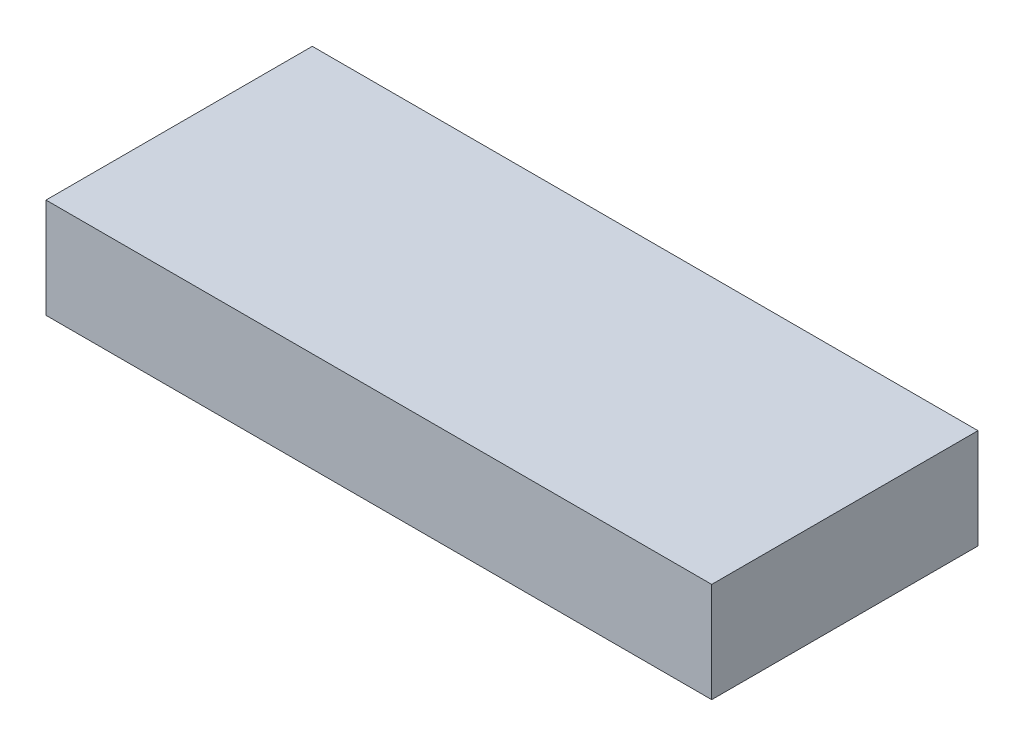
SolidWorks part; units mm, degrees
ref_plane "Front Plane" through (0, 0, 0) normal (0, 0, 1) x (1, 0, 0)
ref_plane "Top Plane" through (0, 0, 0) normal (0, 1, 0) x (1, 0, 0)
ref_plane "Right Plane" through (0, 0, 0) normal (1, 0, 0) x (0, 0, -1)
sketch "Sketch1" plane through (0, 0, 0) normal (0, 1, 0) x (1, 0, 0)
  line L1 (0, 0) -> (254, 0)
  line L2 (0, 0) -> (0, 101.6)
  line L3 (0, 101.6) -> (254, 101.6)
  line L4 (254, 0) -> (254, 101.6)
  dimension "D1" = 254
  dimension "D2" = 101.6
extrude "Extrude1" add sketch "Sketch1" along normal blind 38.1
sketch "Sketch2" plane through (0, 0, 0) normal (0, -1, 0) x (1, 0, 0)
  line L0 (0, -76.2) -> (63.5, -76.2)
  line L1 (0, -101.6) -> (0, 0) construction
  line L2 (172.5706, -84.4176) -> (228.6, -114.3)
  line L4 (254, 0) -> (254, -101.6) construction
  line L5 (254, -101.6) -> (0, -101.6) construction
  arc A0 (63.5, -76.2) -> (88.9, -50.8) centre (63.5, -50.8) ccw
  arc A1 (88.9, -50.8) -> (152.4, -50.8) centre (120.65, -50.8) cw
  arc A2 (152.4, -50.8) -> (172.5706, -84.4176) centre (190.5, -50.8) ccw
  dimension "D3" = 25.4
  dimension "D4" = 31.75
  dimension "D5" = 38.1
  dimension "D1" = 76.2
  dimension "D2" = 63.5
  dimension "D6" = 25.4
  dimension "D7" = 12.7
sketch "Sketch3" plane through (0, 0, 0) normal (-1, 0, 0) x (0, 0, 1)
  line L0 (-82.55, 0) -> (-82.55, 6.35)
  line L1 (-101.6, 0) -> (0, 0) construction
  line L2 (-82.55, 6.35) -> (-88.9, 6.35)
  line L3 (-88.9, 6.35) -> (-88.9, 12.7)
  line L4 (-88.9, 12.7) -> (-82.55, 12.7)
  line L5 (-82.55, 12.7) -> (-82.55, 25.4)
  line L6 (-82.55, 25.4) -> (-69.85, 25.4)
  line L7 (-69.85, 25.4) -> (-69.85, 12.7)
  line L8 (-69.85, 12.7) -> (-63.5, 12.7)
  line L9 (-63.5, 12.7) -> (-63.5, 6.35)
  line L10 (-63.5, 6.35) -> (-69.85, 6.35)
  line L11 (-69.85, 6.35) -> (-69.85, 0)
  line L14 (-101.6, 38.1) -> (-101.6, 0) construction
  line L15 (-82.55, 0) -> (-69.85, 0)
  dimension "D1" = 6.35
  dimension "D2" = 12.7
  dimension "D3" = 25.4
  dimension "D4" = 12.7
  dimension "D5" = 25.4
  dimension "D6" = 19.05
  dimension "D7" = 12.7
sweep "Cut-Sweep1" cut profiles "Sketch3" path "Sketch2"
